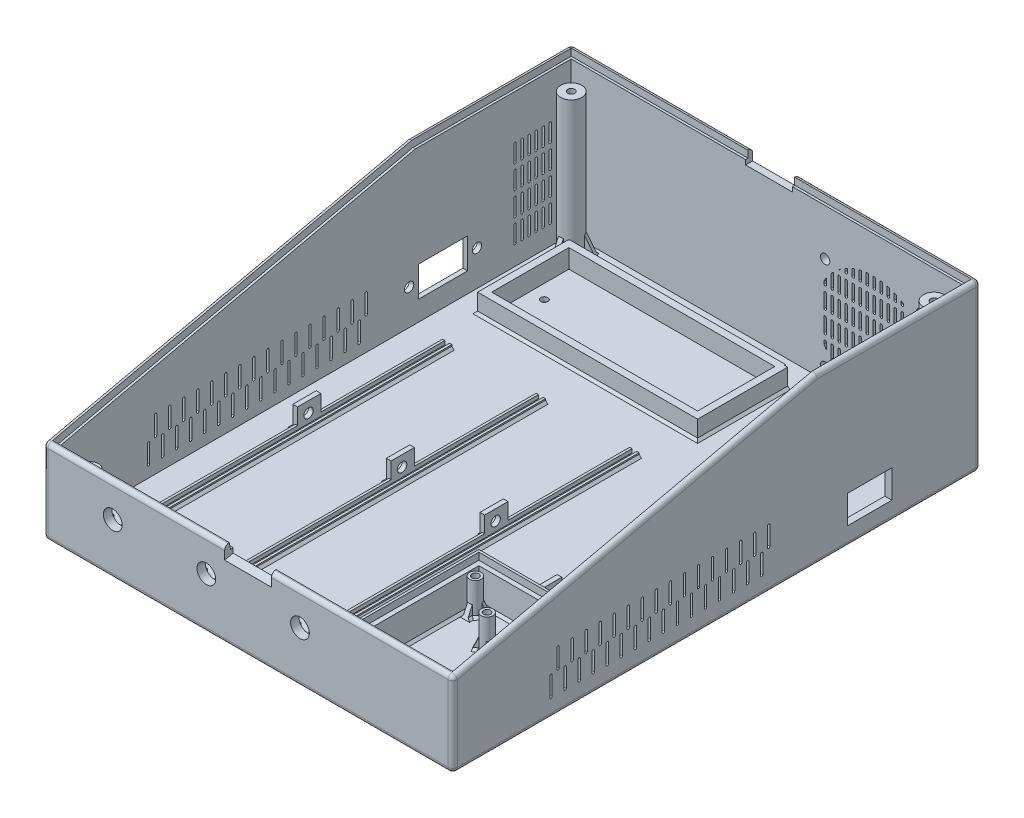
SolidWorks part; units mm, degrees
ref_plane "Front Plane" through (0, 0, 0) normal (0, 0, 1) x (1, 0, 0)
ref_plane "Top Plane" through (0, 0, 0) normal (0, 1, 0) x (1, 0, 0)
ref_plane "Right Plane" through (0, 0, 0) normal (1, 0, 0) x (0, 0, -1)
sketch "Sketch2" plane through (0, 0, 0) normal (1, 0, 0) x (0, 0, -1)
  line L0 (0, 0) -> (0, 70.8142)
  line L1 (0, 70.8142) -> (-70, 70.8142)
  line L2 (-70, 70.8142) -> (-225.622, 36)
  line L3 (-225.622, 36) -> (-225.622, 0)
  line L7 (-201.473, 0) -> (-24.15, 0)
  line L8 (-15, 0) -> (0, 0)
  line L9 (-210.622, 0) -> (-225.622, 0)
  line L10 (-210.622, 0) -> (-201.473, 0)
  line L11 (-24.15, 0) -> (-15, 0)
  dimension "D1" = 70
  dimension "D2" = 102.61
  dimension "D3" = 36
  dimension "D5" = 15
  dimension "D6" = 15
  dimension "D7" = 155.622
  dimension "D8" = 9.149
  dimension "D9" = 9.15
  dimension "D10" = 70.8142
  dimension "D11" = 167.39
extrude "Boss-Extrude1" add sketch "Sketch2" against normal blind 175
sketch "Sketch4" plane through (0, 70.8142, 0) normal (0, 1, 0) x (1, 0, 0)
  line L0 (-87.5, -70) -> (-87.5, 0) construction
  line L1 (-175, -70) -> (0, -70) construction
  line L2 (-175, 0) -> (0, 0) construction
  line L5 (-173, -70) -> (-2, -70)
  line L6 (-173, -70) -> (-173, -2)
  line L7 (-173, -2) -> (-2, -2)
  line L8 (-2, -70) -> (-2, -2)
  dimension "D1" = 2
  dimension "D2" = 2
  dimension "D3" = 2
extrude "Cut-Extrude1" cut sketch "Sketch4" against normal blind 3
sketch "Sketch5" plane through (0, 82.3524, 18.423) normal (0, 0.9759, 0.2183) x (1, 0, 0)
  line L0 (-175, -212.3204) -> (0, -212.3204) construction
  line L1 (-173, -52.8518) -> (-2, -52.8518)
  line L2 (-173, -52.8518) -> (-173, -210.3204)
  line L3 (-173, -210.3204) -> (-2, -210.3204)
  line L4 (-2, -52.8518) -> (-2, -210.3204)
  dimension "D1" = 2
  dimension "D2" = 2
  dimension "D3" = 2
extrude "Cut-Extrude2" cut sketch "Sketch5" against normal blind 3
sketch "Sketch6" plane through (0, 67.8142, 0) normal (0, 1, 0) x (1, 0, 0)
  line L0 (-2, -69.6685) -> (-2, -2) construction
  line L1 (-172, -3) -> (-3, -3)
  line L2 (-172, -3) -> (-172, -222.0153)
  line L3 (-172, -222.0153) -> (-3, -222.0153)
  line L4 (-3, -3) -> (-3, -222.0153)
  line L5 (-173, -2) -> (-173, -69.6685) construction
  line L6 (-2, -2) -> (-173, -2) construction
  line L7 (-173, -223.0153) -> (-2, -223.0153) construction
  dimension "D1" = 1
  dimension "D2" = 1
  dimension "D3" = 1
  dimension "D4" = 1
extrude "Cut-Extrude3" cut sketch "Sketch6" against normal offset from surface (64.8142 mm away) 3
sketch "Sketch11" plane through (0, 82.3524, 18.423) normal (0, 0.9759, 0.2183) x (1, 0, 0)
  line L0 (-172, -209.2957) -> (-3, -209.2957) construction
  line L1 (-97.5, -209.2957) -> (-77.5, -209.2957)
  line L2 (-97.5, -209.2957) -> (-97.5, -217.2957)
  line L3 (-97.5, -217.2957) -> (-77.5, -217.2957)
  line L4 (-77.5, -209.2957) -> (-77.5, -217.2957)
  line L5 (-77.5, -209.2957) -> (-3, -209.2957) construction
  line L6 (-97.5, -209.2957) -> (-172, -209.2957) construction
  dimension "D1" = 20
  dimension "D2" = 8
extrude "Cut-Extrude5" cut sketch "Sketch11" against normal blind 5
sketch "Sketch12" plane through (0, 70.8142, 0) normal (0, 1, 0) x (1, 0, 0)
  line L0 (-175, 0) -> (0, 0) construction
  line L1 (-97.5, 0) -> (-77.5, 0)
  line L2 (-97.5, 0) -> (-97.5, -3)
  line L3 (-97.5, -3) -> (-77.5, -3)
  line L4 (-77.5, 0) -> (-77.5, -3)
  line L5 (-3, -3) -> (-172, -3) construction
  line L6 (-77.5, 0) -> (0, 0) construction
  line L7 (-97.5, 0) -> (-175, 0) construction
  dimension "D1" = 20
extrude "Cut-Extrude6" cut sketch "Sketch12" against normal blind 5
sketch "Sketch13" plane through (-172, 0, 0) normal (1, 0, 0) x (0, 0, -1)
  line L1 (-222.0153, 3) -> (-219.4753, 3)
  line L2 (-222.0153, 3) -> (-222.0153, 5.44)
  line L3 (-222.0153, 5.44) -> (-219.4753, 5.44)
  line L4 (-219.4753, 3) -> (-219.4753, 5.44)
  dimension "D1" = 2.54
  dimension "D2" = 2.44
extrude "Boss-Extrude2" add sketch "Sketch13" along normal up to surface (169 mm away)
sketch "Sketch14" plane through (0, 3, 0) normal (0, 1, 0) x (1, 0, 0)
  circle A0 centre (-165, -10) radius 3
  circle A1 centre (-10, -10) radius 3
  dimension "D1" = 6
extrude "Boss-Extrude3" add sketch "Sketch14" along normal blind 59.81
sketch "Sketch16" plane through (0, 62.81, 0) normal (0, 1, 0) x (1, 0, 0)
  circle A0 centre (-165, -10) radius 1.5
  circle A1 centre (-10, -10) radius 1.5
  dimension "D1" = 3
extrude "Cut-Extrude7" cut sketch "Sketch16" against normal blind 20
sketch "Sketch18" plane through (0, 3, 0) normal (0, 1, 0) x (1, 0, 0)
  circle A2 centre (-10, -216.0167) radius 3
  circle A3 centre (-165, -216.0167) radius 3
  dimension "D1" = 6
extrude "Boss-Extrude5" add sketch "Sketch18" along normal blind 23
sketch "Sketch19" plane through (0, 26, 0) normal (0, 1, 0) x (1, 0, 0)
  circle A0 centre (-10, -216.0167) radius 1.5
  circle A1 centre (-165, -216.0167) radius 1.5
  dimension "D1" = 3
extrude "Cut-Extrude8" cut sketch "Sketch19" against normal blind 20
sketch "Sketch21" plane through (0, 3, 0) normal (0, 1, 0) x (1, 0, 0)
  line L0 (-3, -219.4753) -> (-172, -219.4753) construction
  line L5 (-159, -71.0153) -> (-155, -71.0153)
  line L6 (-159, -71.0153) -> (-159, -219.4753)
  line L7 (-159, -219.4753) -> (-155, -219.4753)
  line L8 (-155, -71.0153) -> (-155, -219.4753)
  line L9 (-159, -71.0153) -> (-155, -219.4753) construction
  line L10 (-159, -219.4753) -> (-155, -71.0153) construction
  line L11 (-119, -71.0153) -> (-115, -71.0153)
  line L12 (-119, -71.0153) -> (-119, -219.4753)
  line L13 (-119, -219.4753) -> (-115, -219.4753)
  line L14 (-115, -71.0153) -> (-115, -219.4753)
  line L15 (-119, -71.0153) -> (-115, -219.4753) construction
  line L16 (-119, -219.4753) -> (-115, -71.0153) construction
  line L17 (-79, -71.0153) -> (-75, -71.0153)
  line L18 (-79, -71.0153) -> (-79, -219.4753)
  line L19 (-79, -219.4753) -> (-75, -219.4753)
  line L20 (-75, -71.0153) -> (-75, -219.4753)
  line L21 (-79, -71.0153) -> (-75, -219.4753) construction
  line L22 (-79, -219.4753) -> (-75, -71.0153) construction
  line L23 (-39, -71.0153) -> (-35, -71.0153)
  line L24 (-39, -71.0153) -> (-39, -219.4753)
  line L25 (-39, -219.4753) -> (-35, -219.4753)
  line L26 (-35, -71.0153) -> (-35, -219.4753)
  line L27 (-39, -71.0153) -> (-35, -219.4753) construction
  line L28 (-39, -219.4753) -> (-35, -71.0153) construction
  line L29 (-3, -219.4753) -> (-3, -3) construction
  line L30 (-172, -3) -> (-172, -219.4753) construction
  point P0 (-157, -145.2453)
  point P1 (-117, -145.2453)
  point P10 (-77, -145.2453)
  point P15 (-37, -145.2453)
  dimension "D1" = 40
  dimension "D2" = 40
  dimension "D3" = 40
  dimension "D4" = 148.46
  dimension "D5" = 4
  dimension "D6" = 32
  dimension "D7" = 13
extrude "Boss-Extrude6" add sketch "Sketch21" along normal blind 1.6
sketch "Sketch22" plane through (0, 4.6, 0) normal (0, 1, 0) x (1, 0, 0)
  line L0 (-75, -71.0153) -> (-79, -71.0153) construction
  line L1 (-78, -71.0153) -> (-76, -71.0153)
  line L2 (-78, -71.0153) -> (-78, -219.4753)
  line L3 (-78, -219.4753) -> (-76, -219.4753)
  line L4 (-76, -71.0153) -> (-76, -219.4753)
  line L5 (-79, -219.4753) -> (-75, -219.4753) construction
  line L6 (-115, -71.0153) -> (-119, -71.0153) construction
  line L7 (-118, -71.0153) -> (-116, -71.0153)
  line L8 (-118, -71.0153) -> (-118, -219.4753)
  line L9 (-118, -219.4753) -> (-116, -219.4753)
  line L10 (-116, -71.0153) -> (-116, -219.4753)
  line L11 (-119, -219.4753) -> (-115, -219.4753) construction
  line L12 (-155, -71.0153) -> (-159, -71.0153) construction
  line L13 (-158, -71.0153) -> (-156, -71.0153)
  line L14 (-158, -71.0153) -> (-158, -219.4753)
  line L15 (-158, -219.4753) -> (-156, -219.4753)
  line L16 (-156, -71.0153) -> (-156, -219.4753)
  line L17 (-159, -219.4753) -> (-155, -219.4753) construction
  line L18 (-155, -219.4753) -> (-156, -219.4753) construction
  line L19 (-159, -219.4753) -> (-158, -219.4753) construction
  line L20 (-115, -219.4753) -> (-116, -219.4753) construction
  line L21 (-118, -219.4753) -> (-119, -219.4753) construction
  line L22 (-78, -219.4753) -> (-79, -219.4753) construction
  line L23 (-76, -219.4753) -> (-75, -219.4753) construction
  dimension "D1" = 2
  dimension "D2" = 148.46
extrude "Cut-Extrude9" cut sketch "Sketch22" against normal up to surface (1.6 mm away)
sketch "Sketch24" plane through (0, 4.6, 0) normal (0, 1, 0) x (1, 0, 0)
  line L0 (-35, -219.4753) -> (-35, -71.0153) construction
  line L1 (-39, -71.0153) -> (-35, -71.0153)
  line L2 (-39, -71.0153) -> (-39, -157.0153)
  line L3 (-39, -157.0153) -> (-35, -157.0153)
  line L4 (-35, -71.0153) -> (-35, -157.0153)
  dimension "D1" = 86
extrude "Boss-Extrude7" add sketch "Sketch24" along normal blind 1.4
sketch "Sketch25" plane through (0, 4.6, 0) normal (0, 1, 0) x (1, 0, 0)
  line L1 (-39, -157.0153) -> (-35, -157.0153)
  line L2 (-39, -157.0153) -> (-39, -219.4753)
  line L3 (-39, -219.4753) -> (-35, -219.4753)
  line L4 (-35, -157.0153) -> (-35, -219.4753)
extrude "Cut-Extrude10" cut sketch "Sketch25" against normal up to surface (1.6 mm away)
sketch "Sketch26" plane through (0, 6, 0) normal (0, 1, 0) x (1, 0, 0)
  line L0 (-35, -157.0153) -> (-35, -71.0153) construction
  line L1 (-39, -71.0153) -> (-35, -71.0153)
  line L2 (-39, -71.0153) -> (-39, -101.5153)
  line L3 (-39, -101.5153) -> (-35, -101.5153)
  line L4 (-35, -71.0153) -> (-35, -101.5153)
  dimension "D1" = 30.5
extrude "Boss-Extrude8" add sketch "Sketch26" along normal blind 5
sketch "Sketch27" plane through (0, 11, 0) normal (0, 1, 0) x (1, 0, 0)
  line L0 (-35, -71.0153) -> (-39, -71.0153) construction
  line L1 (-38, -71.0153) -> (-36, -71.0153)
  line L2 (-38, -71.0153) -> (-38, -157.0153)
  line L3 (-38, -157.0153) -> (-36, -157.0153)
  line L4 (-36, -71.0153) -> (-36, -157.0153)
  line L5 (-39, -71.0153) -> (-38, -71.0153) construction
  line L6 (-36, -71.0153) -> (-35, -71.0153) construction
  line L7 (-39, -157.0153) -> (-35, -157.0153) construction
  dimension "D1" = 2
extrude "Cut-Extrude11" cut sketch "Sketch27" against normal up to surface (8 mm away)
sketch "Sketch28" plane through (0, 0, 222.0153) normal (0, 0, -1) x (-1, 0, 0)
  line L15 (3, 5.44) -> (172, 5.44) construction
  line L16 (155, 5.44) -> (159, 5.44)
  line L17 (155, 5.44) -> (155, 25.44)
  line L18 (155, 25.44) -> (159, 25.44)
  line L19 (159, 5.44) -> (159, 25.44)
  line L20 (172, 5.44) -> (172, 33.7327) construction
  line L21 (115, 5.44) -> (119, 5.44)
  line L22 (115, 5.44) -> (115, 25.44)
  line L23 (115, 25.44) -> (119, 25.44)
  line L24 (119, 5.44) -> (119, 25.44)
  line L25 (75, 5.44) -> (79, 5.44)
  line L26 (75, 5.44) -> (75, 25.44)
  line L27 (75, 25.44) -> (79, 25.44)
  line L28 (79, 5.44) -> (79, 25.44)
  line L29 (119, 5.44) -> (155, 5.44) construction
  line L30 (119, 3) -> (155, 3) construction
  line L31 (79, 5.44) -> (115, 5.44) construction
  line L32 (79, 3) -> (115, 3) construction
  dimension "D1" = 20
  dimension "D2" = 4
  dimension "D3" = 13
extrude "Boss-Extrude9" add sketch "Sketch28" along normal blind 2
sketch "Sketch29" plane through (0, 0, 220.0153) normal (0, 0, -1) x (-1, 0, 0)
  line L0 (75, 5.44) -> (79, 5.44) construction
  line L1 (75, 25.44) -> (78, 25.44)
  line L2 (75, 25.44) -> (75, 5.44)
  line L3 (75, 5.44) -> (78, 5.44)
  line L4 (78, 25.44) -> (78, 5.44)
  line L5 (115, 5.44) -> (119, 5.44) construction
  line L6 (115, 25.44) -> (118, 25.44)
  line L7 (115, 25.44) -> (115, 5.44)
  line L8 (115, 5.44) -> (118, 5.44)
  line L9 (118, 25.44) -> (118, 5.44)
  line L10 (155, 5.44) -> (159, 5.44) construction
  line L11 (155, 25.44) -> (158, 25.44)
  line L12 (155, 25.44) -> (155, 5.44)
  line L13 (155, 5.44) -> (158, 5.44)
  line L14 (158, 25.44) -> (158, 5.44)
  dimension "D1" = 3
  dimension "D2" = 3
  dimension "D3" = 3
extrude "Cut-Extrude12" cut sketch "Sketch29" against normal up to surface (2 mm away)
sketch "Sketch31" plane through (0, 3, 0) normal (0, 1, 0) x (1, 0, 0)
  line L1 (-158, -219.4753) -> (-160, -219.4753)
  line L2 (-158, -219.4753) -> (-158, -212.4753)
  line L3 (-158, -212.4753) -> (-160, -212.4753)
  line L4 (-160, -219.4753) -> (-160, -212.4753)
  line L5 (-118, -219.4753) -> (-120, -219.4753)
  line L6 (-118, -219.4753) -> (-118, -212.4753)
  line L7 (-118, -212.4753) -> (-120, -212.4753)
  line L8 (-120, -219.4753) -> (-120, -212.4753)
  line L9 (-78, -219.4753) -> (-80, -219.4753)
  line L10 (-78, -219.4753) -> (-78, -212.4753)
  line L11 (-78, -212.4753) -> (-80, -212.4753)
  line L12 (-80, -219.4753) -> (-80, -212.4753)
  dimension "D1" = 2
  dimension "D2" = 7
extrude "Boss-Extrude10" add sketch "Sketch31" along normal blind 8
sketch "Sketch32" plane through (-158, 0, 0) normal (1, 0, 0) x (0, 0, -1)
  line L0 (-219.4753, 3) -> (-71.0153, 3) construction
  line L1 (-219.4753, 4.6) -> (-219.4753, 3) construction
  circle A0 centre (-216.4753, 7.7) radius 2
  dimension "D1" = 4
  dimension "D2" = 4.7
  dimension "D3" = 3
extrude "Cut-Extrude13" cut sketch "Sketch32" against normal up to surface (2 mm away)
sketch "Sketch33" plane through (-118, 0, 0) normal (1, 0, 0) x (0, 0, -1)
  line L0 (-219.4753, 4.6) -> (-219.4753, 3) construction
  line L1 (-219.4753, 3) -> (-71.0153, 3) construction
  circle A0 centre (-216.4753, 7.3) radius 2
  dimension "D1" = 4
  dimension "D2" = 3
  dimension "D3" = 4.3
extrude "Cut-Extrude14" cut sketch "Sketch33" against normal up to surface (2 mm away)
sketch "Sketch34" plane through (-78, 0, 0) normal (1, 0, 0) x (0, 0, -1)
  line L0 (-219.4753, 4.6) -> (-219.4753, 3) construction
  line L1 (-219.4753, 3) -> (-71.0153, 3) construction
  circle A0 centre (-216.4753, 7.3) radius 2
  dimension "D1" = 4
  dimension "D2" = 3
  dimension "D3" = 4.3
extrude "Cut-Extrude15" cut sketch "Sketch34" against normal up to surface (2 mm away)
sketch "Sketch36" plane through (0, 3, 0) normal (0, 1, 0) x (1, 0, 0)
  line L0 (-158, -71.0153) -> (-158, -212.4753) construction
  line L1 (-158, -123.9753) -> (-160, -123.9753)
  line L2 (-158, -123.9753) -> (-158, -133.9753)
  line L3 (-158, -133.9753) -> (-160, -133.9753)
  line L4 (-160, -123.9753) -> (-160, -133.9753)
  line L5 (-120, -219.4753) -> (-155, -219.4753) construction
  line L6 (-118, -71.0153) -> (-118, -219.4753) construction
  line L7 (-118, -123.9753) -> (-120, -123.9753)
  line L8 (-118, -123.9753) -> (-118, -133.9753)
  line L9 (-118, -133.9753) -> (-120, -133.9753)
  line L10 (-120, -123.9753) -> (-120, -133.9753)
  line L11 (-78, -71.0153) -> (-78, -219.4753) construction
  line L12 (-78, -123.9753) -> (-80, -123.9753)
  line L13 (-78, -123.9753) -> (-78, -133.9753)
  line L14 (-78, -133.9753) -> (-80, -133.9753)
  line L15 (-80, -123.9753) -> (-80, -133.9753)
  dimension "D1" = 2
  dimension "D2" = 10
  dimension "D3" = 85.5
extrude "Boss-Extrude11" add sketch "Sketch36" along normal blind 8.5
sketch "Sketch37" plane through (-158, 0, 0) normal (1, 0, 0) x (0, 0, -1)
  line L0 (-219.4753, 3) -> (-71.0153, 3) construction
  line L1 (-133.9753, 11.5) -> (-133.9753, 3) construction
  circle A0 centre (-129.2753, 6.9) radius 2
  dimension "D1" = 4
  dimension "D2" = 3.9
  dimension "D3" = 4.7
extrude "Cut-Extrude16" cut sketch "Sketch37" against normal up to surface (2 mm away)
sketch "Sketch38" plane through (-118, 0, 0) normal (1, 0, 0) x (0, 0, -1)
  line L0 (-219.4753, 3) -> (-71.0153, 3) construction
  line L1 (-133.9753, 11.5) -> (-133.9753, 4.6) construction
  circle A0 centre (-129.2753, 6.9) radius 2
  dimension "D1" = 4
  dimension "D2" = 3.9
  dimension "D3" = 4.7
extrude "Cut-Extrude17" cut sketch "Sketch38" against normal up to surface (2 mm away)
sketch "Sketch39" plane through (-78, 0, 0) normal (1, 0, 0) x (0, 0, -1)
  line L0 (-219.4753, 3) -> (-71.0153, 3) construction
  line L2 (-133.9753, 11.5) -> (-133.9753, 4.6) construction
  circle A0 centre (-129.2753, 6.9) radius 2
  dimension "D1" = 4
  dimension "D2" = 3.9
  dimension "D3" = 4.7
extrude "Cut-Extrude18" cut sketch "Sketch39" against normal up to surface (2 mm away)
fillet "Fillet1" radius 2
fillet "Fillet2" radius 2 8 edges at (0, 0, 112.811) (-0.5858, 0, 0.5858) (-87.5, 0, 0) (-174.4142, 0, 0.5858) (-175, 0, 112.811) (-174.4142, 0, 225.0362) (-87.5, 0, 225.622) (-0.5858, 0, 225.0362)
fillet "Fillet3" radius 2
sketch "Sketch40" plane through (0, 3, 0) normal (0, 1, 0) x (1, 0, 0)
  line L0 (-38, -101.5153) -> (-38, -157.0153) construction
  line L1 (-38, -149.0153) -> (-40, -149.0153)
  line L2 (-38, -149.0153) -> (-38, -141.0153)
  line L3 (-38, -141.0153) -> (-40, -141.0153)
  line L4 (-40, -149.0153) -> (-40, -141.0153)
  line L5 (-39, -157.0153) -> (-38, -157.0153) construction
  point P6 (-39, -149.0153)
  dimension "D1" = 2
  dimension "D2" = 8
  dimension "D3" = 8
extrude "Boss-Extrude12" add sketch "Sketch40" along normal blind 9
sketch "Sketch41" plane through (0, 6, 0) normal (0, 1, 0) x (1, 0, 0)
  line L0 (-36, -157.0153) -> (-36, -101.5153) construction
  line L1 (-36, -148.0153) -> (-35, -148.0153)
  line L2 (-36, -148.0153) -> (-36, -142.0153)
  line L3 (-36, -142.0153) -> (-35, -142.0153)
  line L4 (-35, -148.0153) -> (-35, -142.0153)
  line L5 (-35, -157.0153) -> (-35, -101.5153) construction
  line L6 (-36, -157.0153) -> (-35, -157.0153) construction
  dimension "D1" = 6
  dimension "D2" = 9
extrude "Cut-Extrude19" cut sketch "Sketch41" against normal up to surface (3 mm away)
sketch "Sketch42" plane through (-40, 0, 0) normal (-1, 0, 0) x (0, 0, 1)
  line L0 (141.0153, 3) -> (149.0153, 3) construction
  line L2 (157.0153, 6) -> (157.0153, 3) construction
  circle A0 centre (145.1953, 7.19) radius 2
  dimension "D1" = 4
  dimension "D2" = 4.19
  dimension "D3" = 11.82
extrude "Cut-Extrude20" cut sketch "Sketch42" against normal up to surface (2 mm away)
sketch "Sketch44" plane through (0, 3, 0) normal (0, 1, 0) x (1, 0, 0)
  line L1 (-38, -71.0153) -> (-40, -71.0153)
  line L2 (-38, -71.0153) -> (-38, -79.0153)
  line L3 (-38, -79.0153) -> (-40, -79.0153)
  line L4 (-40, -71.0153) -> (-40, -79.0153)
  dimension "D1" = 2
  dimension "D2" = 8
extrude "Boss-Extrude13" add sketch "Sketch44" along normal blind 17
sketch "Sketch45" plane through (-40, 0, 0) normal (-1, 0, 0) x (0, 0, 1)
  line L0 (71.0153, 20) -> (71.0153, 3) construction
  line L1 (71.0153, 3) -> (79.0153, 3) construction
  circle A0 centre (74.0653, 14.5) radius 2
  dimension "D1" = 4
  dimension "D2" = 3.05
  dimension "D3" = 11.5
extrude "Cut-Extrude21" cut sketch "Sketch45" against normal up to surface (2 mm away)
sketch "Sketch46" plane through (0, 3, 0) normal (0, 1, 0) x (1, 0, 0)
  line L0 (-3, -219.4753) -> (-75, -219.4753) construction
  line L1 (-58, -156.4753) -> (-15, -156.4753)
  line L2 (-58, -156.4753) -> (-58, -219.4753)
  line L3 (-58, -219.4753) -> (-15, -219.4753)
  line L4 (-15, -156.4753) -> (-15, -219.4753)
  line L9 (-75, -219.4753) -> (-75, -71.0153) construction
  dimension "D1" = 43
  dimension "D2" = 63
  dimension "D3" = 17
extrude "Boss-Extrude14" add sketch "Sketch46" along normal blind 17
sketch "Sketch47" plane through (0, 20, 0) normal (0, 1, 0) x (1, 0, 0)
  line L8 (-57, -157.4753) -> (-57, -218.4753)
  line L9 (-57, -218.4753) -> (-16, -218.4753)
  line L10 (-16, -218.4753) -> (-16, -157.4753)
  line L11 (-16, -157.4753) -> (-57, -157.4753)
  line L12 (-57, -157.4753) -> (-57, -218.4753)
  line L13 (-57, -218.4753) -> (-16, -218.4753)
  line L14 (-16, -218.4753) -> (-16, -157.4753)
  line L15 (-16, -157.4753) -> (-57, -157.4753)
  dimension "D1" = 1
extrude "Cut-Extrude24" cut sketch "Sketch47" against normal blind 3
sketch "Sketch49" plane through (0, 17, 0) normal (0, 1, 0) x (1, 0, 0)
  line L8 (-18, -159.4753) -> (-55, -159.4753)
  line L9 (-55, -159.4753) -> (-55, -216.4753)
  line L10 (-55, -216.4753) -> (-18, -216.4753)
  line L11 (-18, -216.4753) -> (-18, -159.4753)
  line L12 (-18, -159.4753) -> (-55, -159.4753)
  line L13 (-55, -159.4753) -> (-55, -216.4753)
  line L14 (-55, -216.4753) -> (-18, -216.4753)
  line L15 (-18, -216.4753) -> (-18, -159.4753)
  dimension "D1" = 2
extrude "Cut-Extrude25" cut sketch "Sketch49" against normal up to surface (14 mm away)
sketch "Sketch51" plane through (0, 26, 0) normal (0, 1, 0) x (1, 0, 0)
  circle A0 centre (-165, -216.0167) radius 4
  circle A1 centre (-10, -216.0167) radius 4
  dimension "D1" = 8
extrude "Boss-Extrude15" add sketch "Sketch51" against normal up to surface (23 mm away)
sketch "Sketch52" plane through (0, 26, 0) normal (0, 1, 0) x (1, 0, 0)
  circle A0 centre (-165, -216.0167) radius 1.5
  circle A1 centre (-10, -216.0167) radius 1.5
  dimension "D1" = 3
extrude "Cut-Extrude26" cut sketch "Sketch52" against normal blind 10
sketch "Sketch53" plane through (0, 26, 0) normal (0, 1, 0) x (1, 0, 0)
  line L0 (-162.6925, -212.7494) -> (-162.6925, -219.284)
  line L1 (-160, -212.4753) -> (-160, -219.4753) construction
  arc A0 (-162.6925, -219.284) -> (-162.6925, -212.7494) centre (-165, -216.0167) ccw
  dimension "D1" = 8
  dimension "D2" = 2.6925
extrude "Cut-Extrude27" cut sketch "Sketch53" against normal up to surface (23 mm away)
sketch "Sketch56" plane through (0, 62.81, 0) normal (0, 1, 0) x (1, 0, 0)
  circle A0 centre (-165, -10) radius 4.5
  circle A1 centre (-10, -10) radius 4.5
  dimension "D1" = 9
extrude "Boss-Extrude16" add sketch "Sketch56" against normal up to surface (59.81 mm away)
sketch "Sketch57" plane through (0, 62.81, 0) normal (0, 1, 0) x (1, 0, 0)
  circle A0 centre (-165, -10) radius 1.5
  circle A1 centre (-10, -10) radius 1.5
  dimension "D1" = 3
extrude "Cut-Extrude28" cut sketch "Sketch57" against normal blind 10
sketch "Sketch58" plane through (0, 3, 0) normal (0, 1, 0) x (1, 0, 0)
  line L0 (-55, -159.4753) -> (-55, -216.4753) construction
  line L1 (-18, -159.4753) -> (-55, -159.4753) construction
  line L2 (-55, -216.4753) -> (-18, -216.4753) construction
  circle A0 centre (-52, -163.9753) radius 2.5
  circle A1 centre (-36, -174.9753) radius 2.5
  circle A2 centre (-51, -210.4753) radius 2.5
  dimension "D1" = 5
  dimension "D2" = 3
  dimension "D3" = 4.5
  dimension "D4" = 19
  dimension "D5" = 15.5
  dimension "D6" = 4
  dimension "D7" = 6
extrude "Boss-Extrude17" add sketch "Sketch58" along normal up to surface (14 mm away)
sketch "Sketch59" plane through (0, 17, 0) normal (0, 1, 0) x (1, 0, 0)
  circle A0 centre (-52, -163.9753) radius 1.5
  circle A1 centre (-36, -174.9753) radius 1.5
  circle A2 centre (-51, -210.4753) radius 1.5
  dimension "D1" = 3
extrude "Cut-Extrude29" cut sketch "Sketch59" against normal blind 10
sketch "Sketch61" plane through (0, 20, 0) normal (0, 1, 0) x (1, 0, 0)
  line L1 (-40, -71.0153) -> (-38, -71.0153)
  line L2 (-40, -71.0153) -> (-40, -69.0153)
  line L3 (-40, -69.0153) -> (-38, -69.0153)
  line L4 (-38, -71.0153) -> (-38, -69.0153)
  dimension "D1" = 2
  dimension "D2" = 2
extrude "Boss-Extrude18" add sketch "Sketch61" against normal up to surface (17 mm away)
sketch "Sketch66" plane through (0, 0, 3) normal (0, 0, 1) x (1, 0, 0)
  line L0 (-3, 3) -> (-172, 3) construction
  line L1 (-70, 3) -> (-16, 3)
  line L2 (-70, 3) -> (-70, 55.5)
  line L3 (-70, 55.5) -> (-16, 55.5)
  line L4 (-16, 3) -> (-16, 55.5)
  line L5 (-3, 3) -> (-3, 67.8142) construction
  dimension "D1" = 54
  dimension "D2" = 13
  dimension "D3" = 52.5
extrude "Boss-Extrude20" add sketch "Sketch66" along normal blind 11
sketch "Sketch68" plane through (0, 0, 14) normal (0, 0, 1) x (1, 0, 0)
  line L0 (-70, 3) -> (-16, 3) construction
  line L1 (-68.5, 3) -> (-17.5, 3)
  line L2 (-68.5, 3) -> (-68.5, 54)
  line L3 (-68.5, 54) -> (-17.5, 54)
  line L4 (-17.5, 3) -> (-17.5, 54)
  line L5 (-16, 3) -> (-16, 55.5) construction
  dimension "D1" = 51
  dimension "D2" = 1.5
extrude "Cut-Extrude35" cut sketch "Sketch68" against normal up to surface (11 mm away)
sketch "Sketch69" plane through (0, 0, 3) normal (0, 0, 1) x (1, 0, 0)
  line L0 (-68.5, 3) -> (-17.5, 3) construction
  line L1 (-68.5, 54) -> (-68.5, 3) construction
  line L2 (-17.5, 3) -> (-17.5, 54) construction
  circle A0 centre (-63.5, 8) radius 2
  circle A1 centre (-22.5, 8) radius 2
  circle A2 centre (-63.5, 48) radius 2
  circle A3 centre (-22.5, 48) radius 2
  dimension "D3" = 4
  dimension "D1" = 5
  dimension "D2" = 5
  dimension "D4" = 5
  dimension "D5" = 5
  dimension "D6" = 45
extrude "Cut-Extrude36" cut sketch "Sketch69" against normal up to surface (3 mm away)
sketch "Sketch70" plane through (0, 0, 0) normal (0, 0, -1) x (-1, 0, 0)
  circle A0 centre (22.5, 48) radius 3
  circle A1 centre (63.5, 48) radius 3
  circle A2 centre (63.5, 8) radius 3
  circle A3 centre (22.5, 8) radius 3
  dimension "D1" = 6
extrude "Cut-Extrude37" cut sketch "Sketch70" against normal blind 1
sketch "Sketch71" plane through (-3, 0, 0) normal (-1, 0, 0) x (0, 0, 1)
  line L0 (219.4753, 3) -> (3, 3) construction
  line L1 (38, 20) -> (57, 20)
  line L2 (38, 20) -> (38, 8)
  line L3 (38, 8) -> (57, 8)
  line L4 (57, 20) -> (57, 8)
  line L5 (3, 3) -> (3, 67.8142) construction
  dimension "D1" = 19
  dimension "D2" = 12
  dimension "D3" = 5
  dimension "D4" = 35
extrude "Cut-Extrude38" cut sketch "Sketch71" against normal up to surface (3 mm away)
sketch "Sketch79" plane through (0, 0, 3) normal (0, 0, 1) x (1, 0, 0)
  line L0 (-63.5, 8) -> (-22.5, 8) construction
  line L13 (-63.5, 11.5) -> (-63.5, 17.5) construction
  line L14 (-64, 11.5) -> (-64, 17.5)
  line L15 (-63, 11.5) -> (-63, 17.5)
  line L16 (-63.5, 20.5) -> (-63.5, 26.5) construction
  line L17 (-64, 20.5) -> (-64, 26.5)
  line L18 (-63, 20.5) -> (-63, 26.5)
  line L19 (-63.5, 29.5) -> (-63.5, 35.5) construction
  line L20 (-64, 29.5) -> (-64, 35.5)
  line L21 (-63, 29.5) -> (-63, 35.5)
  line L22 (-63.5, 38.5) -> (-63.5, 44.5) construction
  line L23 (-64, 38.5) -> (-64, 44.5)
  line L24 (-63, 38.5) -> (-63, 44.5)
  line L25 (-63.5, 48) -> (-22.5, 48) construction
  arc A8 (-64, 11.5) -> (-63, 11.5) centre (-63.5, 11.5) ccw
  arc A9 (-63, 17.5) -> (-64, 17.5) centre (-63.5, 17.5) ccw
  arc A10 (-64, 20.5) -> (-63, 20.5) centre (-63.5, 20.5) ccw
  arc A11 (-63, 26.5) -> (-64, 26.5) centre (-63.5, 26.5) ccw
  arc A12 (-64, 29.5) -> (-63, 29.5) centre (-63.5, 29.5) ccw
  arc A13 (-63, 35.5) -> (-64, 35.5) centre (-63.5, 35.5) ccw
  arc A14 (-64, 38.5) -> (-63, 38.5) centre (-63.5, 38.5) ccw
  arc A15 (-63, 44.5) -> (-64, 44.5) centre (-63.5, 44.5) ccw
  point P34 (-63.5, 14.5)
  point P39 (-63.5, 23.5)
  point P46 (-63.5, 32.5)
  point P53 (-63.5, 41.5)
  dimension "D12" = 0.5
  dimension "D13" = 0.5
  dimension "D14" = 0.5
  dimension "D15" = 0.5
  dimension "D11" = 6
  dimension "D16" = 3
  dimension "D17" = 3
  dimension "D18" = 3
  dimension "D19" = 3.5
  dimension "D20" = 3.5
sketch "Sketch80" plane through (0, 0, 0) normal (1, 0, 0) x (0, 0, -1)
  line L0 (-183.622, 16) -> (-183.622, 8) construction
  line L1 (-183.122, 16) -> (-183.122, 8)
  line L2 (-184.122, 16) -> (-184.122, 8)
  line L3 (-180.622, 25) -> (-180.622, 17) construction
  line L4 (-180.122, 25) -> (-180.122, 17)
  line L5 (-181.122, 25) -> (-181.122, 17)
  line L6 (-223.622, 2) -> (-2, 2) construction
  line L7 (-223.622, 34.398) -> (-223.622, 2) construction
  arc A0 (-183.122, 16) -> (-184.122, 16) centre (-183.622, 16) ccw
  arc A1 (-184.122, 8) -> (-183.122, 8) centre (-183.622, 8) ccw
  arc A2 (-180.122, 25) -> (-181.122, 25) centre (-180.622, 25) ccw
  arc A3 (-181.122, 17) -> (-180.122, 17) centre (-180.622, 17) ccw
  point P2 (-183.622, 12)
  point P7 (-180.622, 21)
  point P18 (-223.622, 18.199)
  dimension "D2" = 0.5
  dimension "D3" = 0.5
  dimension "D1" = 8
  dimension "D4" = 3
  dimension "D5" = 9
  dimension "D6" = 10
  dimension "D7" = 40
extrude "Cut-Extrude46" cut sketch "Sketch80" against normal up to surface (3 mm away)
pattern_linear "LPattern2" count 16 spacing 6 along (0, 0, -1) of "Cut-Extrude46"
sketch "Sketch81" plane through (-175, 0, 0) normal (-1, 0, 0) x (0, 0, 1)
  line L0 (180.622, 25) -> (180.622, 17) construction
  line L1 (181.122, 25) -> (181.122, 17)
  line L2 (180.122, 25) -> (180.122, 17)
  line L3 (183.622, 16) -> (183.622, 8) construction
  line L4 (184.122, 16) -> (184.122, 8)
  line L5 (183.122, 16) -> (183.122, 8)
  line L6 (2, 2) -> (223.622, 2) construction
  line L7 (223.622, 2) -> (223.622, 34.398) construction
  arc A0 (181.122, 25) -> (180.122, 25) centre (180.622, 25) ccw
  arc A1 (180.122, 17) -> (181.122, 17) centre (180.622, 17) ccw
  arc A2 (184.122, 16) -> (183.122, 16) centre (183.622, 16) ccw
  arc A3 (183.122, 8) -> (184.122, 8) centre (183.622, 8) ccw
  point P2 (180.622, 21)
  point P9 (183.622, 12)
  dimension "D1" = 0.5
  dimension "D2" = 0.5
  dimension "D3" = 8
  dimension "D4" = 3
  dimension "D5" = 9
  dimension "D6" = 10
  dimension "D7" = 40
extrude "Cut-Extrude47" cut sketch "Sketch81" against normal up to surface (3 mm away)
pattern_linear "LPattern3" count 16 spacing 6 along (0, 0, -1) of "Cut-Extrude47"
sketch "Sketch83" plane through (0, 0, 3) normal (0, 0, 1) x (1, 0, 0)
  line L0 (-63.5, 48) -> (-22.5, 8) construction
  line L1 (-68.5, 54) -> (-17.5, 54)
  line L2 (-68.5, 54) -> (-68.5, 3)
  line L3 (-68.5, 3) -> (-17.5, 3)
  line L4 (-17.5, 54) -> (-17.5, 3)
  circle A0 centre (-63.5, 48) radius 2
  circle A1 centre (-22.5, 48) radius 2
  circle A2 centre (-22.5, 8) radius 2
  circle A3 centre (-63.5, 8) radius 2
  circle A4 centre (-43, 28) radius 24
  dimension "D1" = 4
  dimension "D2" = 48
extrude "Boss-Extrude21" add sketch "Sketch83" against normal up to surface (3 mm away)
sketch "Sketch84" plane through (0, 3, 0) normal (0, 1, 0) x (1, 0, 0)
  line L0 (-10, -8.5) -> (-10, -216.0167) construction
  line L2 (-11, -11.5) -> (-9, -11.5)
  line L3 (-11, -11.5) -> (-11, -17.5)
  line L4 (-11, -17.5) -> (-9, -17.5)
  line L5 (-9, -11.5) -> (-9, -17.5)
  line L6 (-11, -11.5) -> (-9, -17.5) construction
  line L7 (-11, -17.5) -> (-9, -11.5) construction
  circle A0 centre (-10, -10) radius 1.5 construction
  circle A1 centre (-10, -10) radius 1.5 construction
  point P7 (-10, -14.5)
  dimension "D1" = 6
  dimension "D2" = 2
  dimension "D3" = 3
extrude "Boss-Extrude22" add sketch "Sketch84" along normal blind 8
sketch "Sketch85" plane through (-11, 0, 0) normal (-1, 0, 0) x (0, 0, 1)
  line L0 (17.5, 3) -> (17.5, 11)
  line L1 (17.5, 11) -> (14.3875, 11)
  line L2 (14.3875, 11) -> (17.5, 3)
extrude "Cut-Extrude49" cut sketch "Sketch85" against normal up to surface (2 mm away)
pattern_circular "CirPattern1" count 3 over 360 of "Boss-Extrude22", "Cut-Extrude49"
sketch "Sketch86" plane through (0, 3, 0) normal (0, 1, 0) x (1, 0, 0)
  line L0 (-165, -10) -> (-165, -216.0167) construction
  line L2 (-166, -12) -> (-164, -12)
  line L3 (-166, -12) -> (-166, -18)
  line L4 (-166, -18) -> (-164, -18)
  line L5 (-164, -12) -> (-164, -18)
  line L6 (-166, -12) -> (-164, -18) construction
  line L7 (-166, -18) -> (-164, -12) construction
  circle A0 centre (-165, -10) radius 1.5 construction
  point P4 (-165, -15)
  point P9 (-165, -12)
  dimension "D1" = 6
  dimension "D2" = 2
  dimension "D3" = 2
extrude "Boss-Extrude23" add sketch "Sketch86" along normal blind 8
sketch "Sketch87" plane through (-164, 0, 0) normal (1, 0, 0) x (0, 0, -1)
  line L0 (-14.3875, 11) -> (-18, 11)
  line L1 (-18, 11) -> (-18, 3)
  line L2 (-18, 3) -> (-14.3875, 11)
extrude "Cut-Extrude50" cut sketch "Sketch87" against normal up to surface (2 mm away)
pattern_circular "CirPattern2" count 3 over 360 of "Boss-Extrude23", "Cut-Extrude50"
sketch "Sketch88" plane through (0, 3, 0) normal (0, 1, 0) x (1, 0, 0)
  line L0 (-165, -10) -> (-165, -216.0167) construction
  line L2 (-164, -208.0167) -> (-166, -208.0167)
  line L3 (-164, -208.0167) -> (-164, -214.0167)
  line L4 (-164, -214.0167) -> (-166, -214.0167)
  line L5 (-166, -208.0167) -> (-166, -214.0167)
  line L6 (-164, -208.0167) -> (-166, -214.0167) construction
  line L7 (-164, -214.0167) -> (-166, -208.0167) construction
  point P4 (-165, -211.0167)
  dimension "D1" = 6
  dimension "D2" = 2
  dimension "D3" = 2
extrude "Boss-Extrude24" add sketch "Sketch88" along normal blind 8
sketch "Sketch89" plane through (-164, 0, 0) normal (1, 0, 0) x (0, 0, -1)
  line L0 (-208.0167, 11) -> (-212.1437, 11)
  line L1 (-212.1437, 11) -> (-208.0167, 3)
  line L2 (-208.0167, 3) -> (-208.0167, 11)
extrude "Cut-Extrude51" cut sketch "Sketch89" against normal up to surface (2 mm away)
sketch "Sketch90" plane through (0, 3, 0) normal (0, 1, 0) x (1, 0, 0)
  line L0 (-10, -10) -> (-10, -216.0167) construction
  line L2 (-11, -209.0167) -> (-9, -209.0167)
  line L3 (-11, -209.0167) -> (-11, -214.0167)
  line L4 (-11, -214.0167) -> (-9, -214.0167)
  line L5 (-9, -209.0167) -> (-9, -214.0167)
  line L6 (-11, -209.0167) -> (-9, -214.0167) construction
  line L7 (-11, -214.0167) -> (-9, -209.0167) construction
  point P4 (-10, -211.5167)
  dimension "D1" = 5
  dimension "D2" = 2
  dimension "D3" = 2
extrude "Boss-Extrude25" add sketch "Sketch90" along normal blind 8
sketch "Sketch91" plane through (-11, 0, 0) normal (-1, 0, 0) x (0, 0, 1)
  line L0 (212.1437, 11) -> (209.0167, 11)
  line L1 (209.0167, 11) -> (209.0167, 3)
  line L2 (209.0167, 3) -> (212.1437, 11)
extrude "Cut-Extrude52" cut sketch "Sketch91" against normal up to surface (2 mm away)
pattern_circular "CirPattern7" count 3 over 360 of "Cut-Extrude52", "Boss-Extrude25"
sketch "Sketch92" plane through (-175, 0, 0) normal (-1, 0, 0) x (0, 0, 1)
  line L0 (2, 2) -> (223.622, 2) construction
  line L1 (39.779, 26) -> (75.779, 26)
  line L2 (39.779, 26) -> (39.779, 10)
  line L3 (39.779, 10) -> (75.779, 10)
  line L4 (75.779, 26) -> (75.779, 10)
  dimension "D1" = 16
  dimension "D2" = 36
  dimension "D3" = 6
  dimension "D4" = 8
extrude "Cut-Extrude53" cut sketch "Sketch92" against normal blind 1
sketch "Sketch94" plane through (-174, 0, 0) normal (-1, 0, 0) x (0, 0, 1)
  line L1 (47.279, 24.5) -> (68.279, 24.5)
  line L2 (47.279, 24.5) -> (47.279, 11.5)
  line L3 (47.279, 11.5) -> (68.279, 11.5)
  line L4 (68.279, 24.5) -> (68.279, 11.5)
  line L5 (47.279, 24.5) -> (68.279, 11.5) construction
  line L6 (47.279, 11.5) -> (68.279, 24.5) construction
  line L7 (57.779, 18) -> (57.779, 26) construction
  line L8 (75.779, 26) -> (39.779, 26) construction
  line L9 (57.779, 18) -> (57.779, 10) construction
  line L10 (39.779, 10) -> (75.779, 10) construction
  line L11 (57.779, 18) -> (39.779, 18) construction
  line L12 (39.779, 26) -> (39.779, 10) construction
  line L13 (57.779, 18) -> (75.779, 18) construction
  line L14 (75.779, 10) -> (75.779, 26) construction
  point P0 (57.779, 18)
  dimension "D1" = 21
  dimension "D2" = 13
extrude "Cut-Extrude54" cut sketch "Sketch94" against normal up to surface (2 mm away)
sketch "Sketch95" plane through (-174, 0, 0) normal (-1, 0, 0) x (0, 0, 1)
  line L0 (43.279, 18) -> (43.279, 26) construction
  line L1 (75.779, 26) -> (39.779, 26) construction
  line L2 (43.279, 26) -> (43.279, 18) construction
  line L3 (43.279, 18) -> (43.279, 10) construction
  line L4 (39.779, 10) -> (75.779, 10) construction
  line L5 (39.779, 26) -> (39.779, 10) construction
  line L6 (75.779, 10) -> (75.779, 26) construction
  circle A0 centre (43.279, 18) radius 2
  circle A1 centre (72.279, 18) radius 2
  dimension "D3" = 4
  dimension "D1" = 3.5
  dimension "D2" = 3.5
extrude "Cut-Extrude55" cut sketch "Sketch95" against normal up to surface (2 mm away)
sketch "Sketch96" plane through (0, 3, 0) normal (0, 1, 0) x (1, 0, 0)
  line L0 (-52, -163.9753) -> (-52, -216.4753) construction
  line L1 (-55, -216.4753) -> (-18, -216.4753) construction
  line L3 (-53, -165.4753) -> (-51, -165.4753)
  line L4 (-53, -165.4753) -> (-53, -168.4753)
  line L5 (-53, -168.4753) -> (-51, -168.4753)
  line L6 (-51, -165.4753) -> (-51, -168.4753)
  line L7 (-53, -165.4753) -> (-51, -168.4753) construction
  line L8 (-53, -168.4753) -> (-51, -165.4753) construction
  point P5 (-52, -166.9753)
  dimension "D1" = 3
  dimension "D2" = 3
  dimension "D3" = 2
extrude "Boss-Extrude26" add sketch "Sketch96" along normal blind 5
sketch "Sketch97" plane through (-51, 0, 0) normal (1, 0, 0) x (0, 0, -1)
  line L0 (-166.2666, 8) -> (-168.4753, 8)
  line L1 (-168.4753, 8) -> (-168.4753, 3)
  line L2 (-168.4753, 3) -> (-166.2666, 8)
extrude "Cut-Extrude56" cut sketch "Sketch97" against normal up to surface (2 mm away)
pattern_circular "CirPattern8" count 3 over 360 of "Boss-Extrude26", "Cut-Extrude56"
sketch "Sketch98" plane through (0, 3, 0) normal (0, 1, 0) x (1, 0, 0)
  line L0 (-51, -210.4753) -> (-51, -159.4753) construction
  line L1 (-18, -159.4753) -> (-55, -159.4753) construction
  line L7 (-52, -205.9753) -> (-50, -205.9753)
  line L8 (-52, -205.9753) -> (-52, -208.9753)
  line L9 (-52, -208.9753) -> (-50, -208.9753)
  line L10 (-50, -205.9753) -> (-50, -208.9753)
  line L11 (-52, -205.9753) -> (-50, -208.9753) construction
  line L12 (-52, -208.9753) -> (-50, -205.9753) construction
  point P5 (-51, -207.4753)
  dimension "D1" = 3
  dimension "D2" = 3
  dimension "D3" = 2
extrude "Boss-Extrude27" add sketch "Sketch98" along normal blind 5
sketch "Sketch99" plane through (-50, 0, 0) normal (1, 0, 0) x (0, 0, -1)
  line L0 (-205.9753, 8) -> (-208.184, 8)
  line L1 (-208.184, 8) -> (-205.9753, 3)
  line L2 (-205.9753, 3) -> (-205.9753, 8)
extrude "Cut-Extrude57" cut sketch "Sketch99" against normal up to surface (2 mm away)
pattern_circular "CirPattern9" count 3 over 360 of "Boss-Extrude27", "Cut-Extrude57"
sketch "Sketch100" plane through (0, 3, 0) normal (0, 1, 0) x (1, 0, 0)
  line L0 (-36, -174.9753) -> (-36, -159.4753) construction
  line L1 (-18, -159.4753) -> (-55, -159.4753) construction
  line L3 (-37, -170.4753) -> (-35, -170.4753)
  line L4 (-37, -170.4753) -> (-37, -173.4753)
  line L5 (-37, -173.4753) -> (-35, -173.4753)
  line L6 (-35, -170.4753) -> (-35, -173.4753)
  line L7 (-37, -170.4753) -> (-35, -173.4753) construction
  line L8 (-37, -173.4753) -> (-35, -170.4753) construction
  point P5 (-36, -171.9753)
  dimension "D1" = 3
  dimension "D2" = 3
  dimension "D3" = 2
extrude "Boss-Extrude28" add sketch "Sketch100" along normal blind 5
sketch "Sketch101" plane through (-37, 0, 0) normal (-1, 0, 0) x (0, 0, 1)
  line L0 (172.684, 8) -> (170.4753, 8)
  line L1 (170.4753, 8) -> (170.4753, 3)
  line L2 (170.4753, 3) -> (172.684, 8)
extrude "Cut-Extrude58" cut sketch "Sketch101" against normal up to next
pattern_circular "CirPattern10" count 3 over 360 of "Boss-Extrude28", "Cut-Extrude58"
sketch "Sketch102" plane through (0, 3, 0) normal (0, 1, 0) x (1, 0, 0)
  line L0 (-68.5, -3) -> (-68.5, -14) construction
  line L1 (-162.5, -13.5) -> (-68.5, -13.5)
  line L2 (-162.5, -13.5) -> (-162.5, -52.5)
  line L3 (-162.5, -52.5) -> (-68.5, -52.5)
  line L4 (-68.5, -13.5) -> (-68.5, -52.5)
  line L5 (-162.5, -13.5) -> (-68.5, -52.5) construction
  line L6 (-70, -3) -> (-172, -3) construction
  point P6 (-115.5, -33)
  dimension "D1" = 94
  dimension "D2" = 30
  dimension "D3" = 39
extrude "Boss-Extrude29" add sketch "Sketch102" along normal blind 8
sketch "Sketch104" plane through (0, 11, 0) normal (0, 1, 0) x (1, 0, 0)
  line L9 (-73, -16.5) -> (-71.5, -16.5)
  line L10 (-71.5, -17) -> (-71.5, -16.5)
  line L12 (-73, -16.5) -> (-159.5, -16.5)
  line L13 (-159.5, -16.5) -> (-159.5, -49.5)
  line L14 (-159.5, -49.5) -> (-71.5, -49.5)
  line L15 (-71.5, -49.5) -> (-71.5, -17)
  line L16 (-71.5, -17) -> (-73, -17)
  line L17 (-73, -17) -> (-73, -16.5)
  line L18 (-73, -16.5) -> (-159.5, -16.5)
  line L19 (-159.5, -16.5) -> (-159.5, -49.5)
  line L20 (-159.5, -49.5) -> (-71.5, -49.5)
  line L21 (-71.5, -49.5) -> (-71.5, -17)
  dimension "D2" = 1.5
  dimension "D1" = 3
extrude "Cut-Extrude59" cut sketch "Sketch104" against normal up to surface (8 mm away)
sketch "Sketch105" plane through (0, 3, 0) normal (0, 1, 0) x (1, 0, 0)
  line L0 (-153.5, -33) -> (-153.5, -16.5) construction
  line L1 (-71.5, -16.5) -> (-159.5, -16.5) construction
  line L2 (-153.5, -33) -> (-153.5, -49.5) construction
  line L3 (-159.5, -49.5) -> (-71.5, -49.5) construction
  line L4 (-159.5, -16.5) -> (-159.5, -49.5) construction
  line L5 (-71.5, -49.5) -> (-71.5, -16.5) construction
  circle A0 centre (-153.5, -33) radius 1.5
  circle A1 centre (-77.5, -33) radius 1.5
  dimension "D1" = 3
  dimension "D2" = 6
  dimension "D3" = 6
extrude "Cut-Extrude60" cut sketch "Sketch105" against normal up to surface (3 mm away)
sketch "Sketch106" plane through (0, 0, 0) normal (0, -1, 0) x (1, 0, 0)
  circle A2 centre (-153.5, 33) radius 2.5
  circle A3 centre (-153.5, 33) radius 2.5
  circle A5 centre (-77.5, 33) radius 2.5
  circle A6 centre (-77.5, 33) radius 2.5
  dimension "D1" = 1
  dimension "D2" = 1
extrude "Cut-Extrude61" cut sketch "Sketch106" against normal blind 1
sketch "Sketch107" plane through (-175, 0, 0) normal (-1, 0, 0) x (0, 0, 1)
  line L0 (12, 11.5) -> (12, 18.5) construction
  line L3 (11.5, 11.5) -> (11.5, 18.5)
  line L6 (2, 2) -> (223.622, 2) construction
  line L8 (12.5, 11.5) -> (12.5, 18.5)
  line L9 (2, 68.8142) -> (2, 2) construction
  arc A4 (11.5, 11.5) -> (12.5, 11.5) centre (12, 11.5) ccw
  arc A5 (12.5, 18.5) -> (11.5, 18.5) centre (12, 18.5) ccw
  point P2 (12, 15)
  dimension "D1" = 0.5
  dimension "D2" = 7
  dimension "D3" = 10
  dimension "D4" = 13
sketch "Sketch109" plane through (0, 0, 222.0153) normal (0, 0, -1) x (-1, 0, 0)
  line L0 (78, 5.44) -> (78, 25.44) construction
  line L1 (118, 5.44) -> (118, 25.44) construction
  line L2 (158, 5.44) -> (158, 25.44) construction
  line L3 (58, 5.44) -> (78, 5.44) construction
  circle A0 centre (65.3, 21.94) radius 4
  circle A1 centre (105.3, 21.94) radius 4
  circle A2 centre (145.3, 21.94) radius 4
  dimension "D1" = 8
  dimension "D2" = 12.7
  dimension "D3" = 12.7
  dimension "D4" = 12.7
  dimension "D5" = 16.5
extrude "Cut-Extrude64" cut sketch "Sketch109" against normal up to surface (3.6067 mm away)
chamfer "Chamfer2" distance 1 angle 45
extrude "Cut-Extrude65" cut sketch "Sketch107" against normal up to next
pattern_linear "LPattern5" count 6 spacing 3 along (0, 0, 1) of "Cut-Extrude65"
pattern_linear "LPattern6" count 4 spacing 10 along (0, 1, 0) of "LPattern5", "Cut-Extrude65"
extrude "Cut-Extrude66" cut sketch "Sketch79" against normal up to next
pattern_linear "LPattern7" count 15 spacing 3 along (1, 0, 0) of "Cut-Extrude66"
sketch "Sketch110" plane through (0, 0, 3) normal (0, 0, 1) x (1, 0, 0)
  line L0 (-57.5, 47.5) -> (-57.5, 51.5) construction
  line L1 (-58, 47.5) -> (-58, 51.5)
  line L2 (-57, 47.5) -> (-57, 51.5)
  line L3 (-57.5, 4.5) -> (-57.5, 8.5) construction
  line L4 (-58, 4.5) -> (-58, 8.5)
  line L5 (-57, 4.5) -> (-57, 8.5)
  line L6 (-58, 44.5) -> (-58, 38.5) construction
  arc A0 (-58, 47.5) -> (-57, 47.5) centre (-57.5, 47.5) ccw
  arc A1 (-57, 51.5) -> (-58, 51.5) centre (-57.5, 51.5) ccw
  arc A2 (-58, 4.5) -> (-57, 4.5) centre (-57.5, 4.5) ccw
  arc A3 (-57, 8.5) -> (-58, 8.5) centre (-57.5, 8.5) ccw
  point P2 (-57.5, 49.5)
  point P7 (-57.5, 6.5)
  dimension "D1" = 0.5
  dimension "D2" = 0.5
  dimension "D3" = 3
  dimension "D4" = 3
  dimension "D5" = 4
extrude "Cut-Extrude67" cut sketch "Sketch110" against normal up to next
pattern_linear "LPattern8" count 11 spacing 3 along (1, 0, 0) of "Cut-Extrude67"
sketch "Sketch111" plane through (0, 0, 3) normal (0, 0, 1) x (1, 0, 0)
  line L0 (-63.5, 48) -> (-22.5, 8) construction
  line L1 (-68.5, 54) -> (-17.5, 54)
  line L2 (-68.5, 54) -> (-68.5, 3)
  line L3 (-68.5, 3) -> (-17.5, 3)
  line L4 (-17.5, 54) -> (-17.5, 3)
  circle A0 centre (-63.5, 48) radius 2
  circle A1 centre (-22.5, 48) radius 2
  circle A2 centre (-63.5, 8) radius 2
  circle A3 centre (-22.5, 8) radius 2
  circle A4 centre (-43, 28) radius 24
  dimension "D1" = 4
  dimension "D2" = 48
extrude "Boss-Extrude30" add sketch "Sketch111" against normal up to surface (3 mm away) contours L2 L1 L4 L3
sketch "Sketch112" plane through (0, 0, 14) normal (0, 0, 1) x (1, 0, 0)
  line L1 (-70, 55.5) -> (-16, 55.5)
  line L2 (-70, 55.5) -> (-70, 3)
  line L3 (-70, 3) -> (-16, 3)
  line L4 (-16, 55.5) -> (-16, 3)
extrude "Cut-Extrude68" cut sketch "Sketch112" against normal up to surface (11 mm away)
chamfer "Chamfer3" distance 1 angle 45
